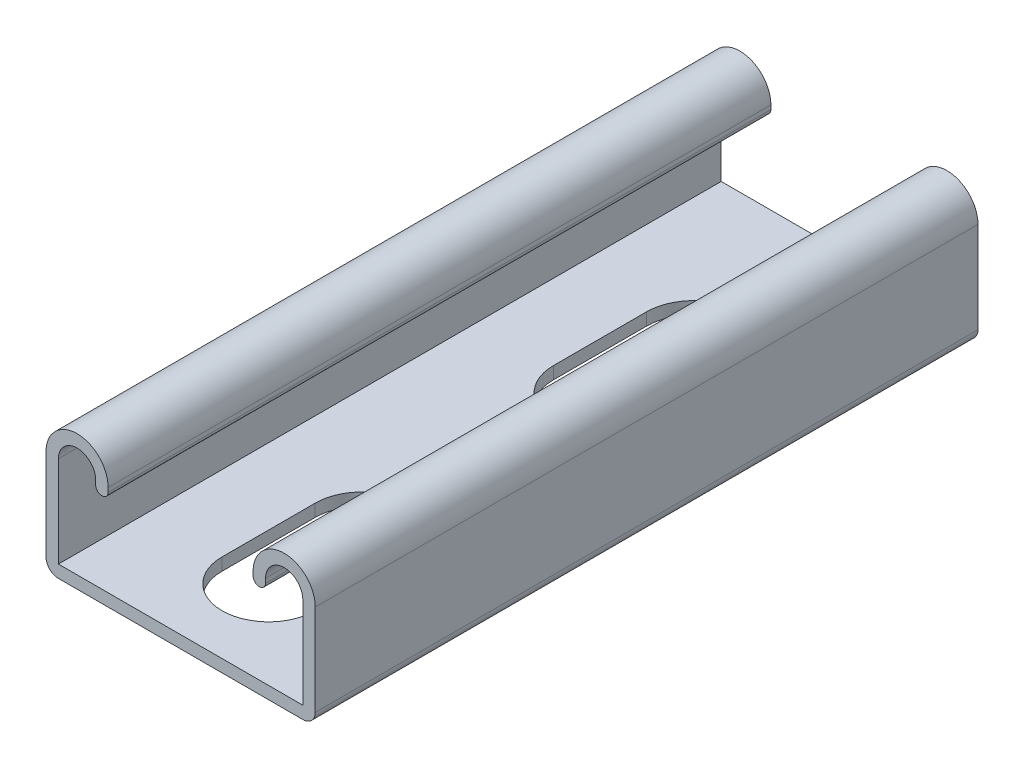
SolidWorks part; units mm, degrees
ref_plane "Plane1" through (0, 0, 0) normal (0, 0, 1) x (1, 0, 0)
ref_plane "Plane2" through (0, 0, 0) normal (0, 1, 0) x (1, 0, 0)
ref_plane "Plane3" through (0, 0, 0) normal (1, 0, 0) x (0, 0, -1)
sketch "Sketch1" plane through (0, 0, 0) normal (0, 0, 1) x (1, 0, 0)
  line L0 (-20.6375, 7.4295) -> (-20.6375, -6.5532)
  line L1 (-18.7325, -8.4582) -> (18.7325, -8.4582)
  line L2 (20.6375, -6.5532) -> (20.6375, 7.4295)
  line L3 (11.1125, 7.4295) -> (11.1125, 6.7945)
  line L4 (-11.1125, 7.4295) -> (-11.1125, 6.7945)
  line L5 (-13.0175, 7.4295) -> (-13.0175, 6.7945)
  line L6 (-18.7325, 7.4295) -> (-18.7325, -6.5532)
  line L7 (-18.7325, -6.5532) -> (18.7325, -6.5532)
  line L8 (18.7325, -6.5532) -> (18.7325, 7.4295)
  line L9 (13.0175, 7.4295) -> (13.0175, 6.7945)
  line L10 (-25.4, 12.192) -> (25.4, 12.192) construction
  line L11 (-12.8524, 5.842) -> (12.8524, 5.842) construction
  arc A0 (20.6375, 7.4295) -> (11.1125, 7.4295) centre (15.875, 7.4295) ccw
  arc A1 (-20.6375, 7.4295) -> (-11.1125, 7.4295) centre (-15.875, 7.4295) cw
  arc A2 (-18.7325, -8.4582) -> (-20.6375, -6.5532) centre (-18.7325, -6.5532) cw
  arc A3 (18.7325, -8.4582) -> (20.6375, -6.5532) centre (18.7325, -6.5532) ccw
  arc A4 (-18.7325, 7.4295) -> (-13.0175, 7.4295) centre (-15.875, 7.4295) cw
  arc A5 (18.7325, 7.4295) -> (13.0175, 7.4295) centre (15.875, 7.4295) ccw
  arc A6 (11.1125, 6.7945) -> (13.0175, 6.7945) centre (12.065, 6.7945) ccw
  arc A7 (-11.1125, 6.7945) -> (-13.0175, 6.7945) centre (-12.065, 6.7945) cw
  dimension "D1" = 1.905
  dimension "D3" = 20.6375
  dimension "Width" = 41.275
  dimension "D5" = 8.4582
  dimension "D6" = 9.525
  dimension "D7" = 22.225
  dimension "D8" = 12.192
  dimension "D9" = 6.35
  dimension "gauge" = 1.905
extrude "Base-Extrude" add sketch "Sketch1" along normal blind 101.6
extrude "Slot" cut sketch "Sketch2" against normal through all
sketch "Sketch2" plane through (-0.5607, -8.4582, -8.3136) normal (0, -1, 0) x (1, 0, 0)
  line L0 (7.7045, 45.6199) -> (7.7045, 31.3324)
  line L1 (-6.583, 31.3324) -> (-6.583, 45.6199)
  arc A0 (-6.583, 31.3324) -> (7.7045, 31.3324) centre (0.5607, 31.3324) ccw
  arc A1 (7.7045, 45.6199) -> (-6.583, 45.6199) centre (0.5607, 45.6199) ccw
  dimension "D3" = 14.2875
  dimension "D1" = 23.0188
  dimension "D2" = 14.2875
pattern_linear "LPattern1" count 2 spacing 50.8 along (0, 0, 1) of "Slot"
equation "\"D3@Sketch1\" = \"Width@Sketch1\" / 2"
equation "\"D7@Sketch1\" = \"Width@Sketch1\" - 2 * \"D6@Sketch1\""
equation "\"D1@Sketch1\" = \"gauge@Sketch1\""
equation "\"D1@LPattern1\" = \"D1@Base-Extrude\" / \"D3@LPattern1\""
